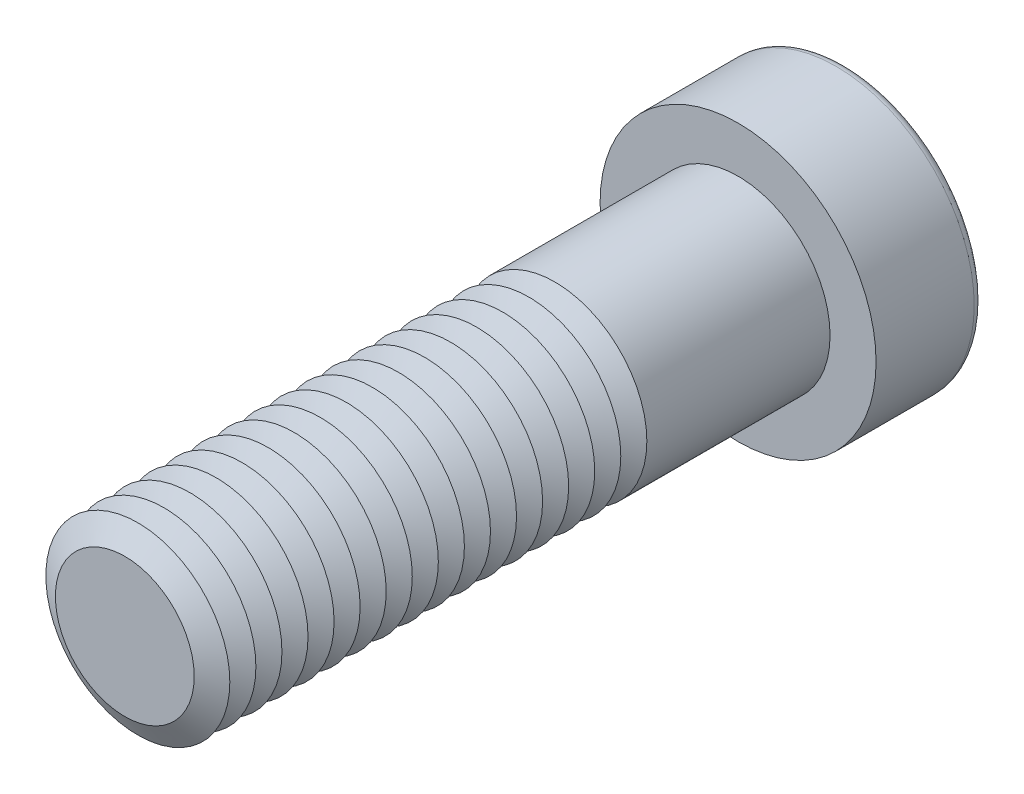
SolidWorks part; units mm, degrees
ref_plane "Front Plane" through (0, 0, 0) normal (0, 0, 1) x (1, 0, 0)
ref_plane "Top Plane" through (0, 0, 0) normal (0, 1, 0) x (1, 0, 0)
ref_plane "Right Plane" through (0, 0, 0) normal (1, 0, 0) x (0, 0, -1)
sketch "Sketch1" plane through (0, 0, 0) normal (0, 0, 1) x (1, 0, 0)
  circle A0 centre (0, 0) radius 6
  dimension "D1" = 12
extrude "Boss-Extrude1" add sketch "Sketch1" along normal blind 40
sketch "Sketch2" plane through (0, 0, 0) normal (0, 0, -1) x (-1, 0, 0)
  circle A0 centre (0, 0) radius 9
  dimension "D1" = 18
extrude "Boss-Extrude2" add sketch "Sketch2" along normal blind 7
sketch "Sketch3" plane through (0, 0, -7) normal (0, 0, -1) x (-1, 0, 0)
  line L1 (-2.3094, 4) -> (-4.6188, 0)
  line L2 (-4.6188, 0) -> (-2.3094, -4)
  line L3 (-2.3094, -4) -> (2.3094, -4)
  line L4 (2.3094, -4) -> (4.6188, 0)
  line L5 (4.6188, 0) -> (2.3094, 4)
  line L6 (2.3094, 4) -> (-2.3094, 4)
  circle A0 centre (0, 0) radius 4 construction
  dimension "D1" = 8
extrude "Cut-Extrude1" cut sketch "Sketch3" against normal blind 6
fillet "Fillet1" radius 0.6 1 edges at (-9, 0, -7)
sketch "Sketch4" plane through (0, 0, -1) normal (0, 0, -1) x (-1, 0, 0)
  line L0 (2.3094, -4) -> (4.6188, 0) construction
  circle A0 centre (0, 0) radius 4
extrude "Cut-Extrude2" cut sketch "Sketch4" against normal through all draft 60
sketch "Sketch5" plane through (0, 0, -7) normal (0, 0, -1) x (-1, 0, 0)
  circle A0 centre (0, 0) radius 4.6188
extrude "Cut-Extrude3" cut sketch "Sketch5" against normal through all draft 75
sketch "Sketch7" plane through (0, 0, 0) normal (1, 0, 0) x (0, 0, -1)
  line L25 (-40, 4.5278) -> (-39.15, 6)
  line L26 (-40, 6) -> (-40, -6) construction
  line L27 (-39.15, 6) -> (-40.85, 6)
  line L28 (-40.85, 6) -> (-40, 4.5278)
  line L29 (0, 6) -> (-40, 6) construction
  dimension "D1" = 1.7
revolve "Cut-Revolve1" cut sketch "Sketch7" angle 360 about axis through (0, 0, 40) along (0, 0, -1)
pattern_linear "LPattern1" count 17 spacing 1.7 along (0, 0, -1) of "Cut-Revolve1"
